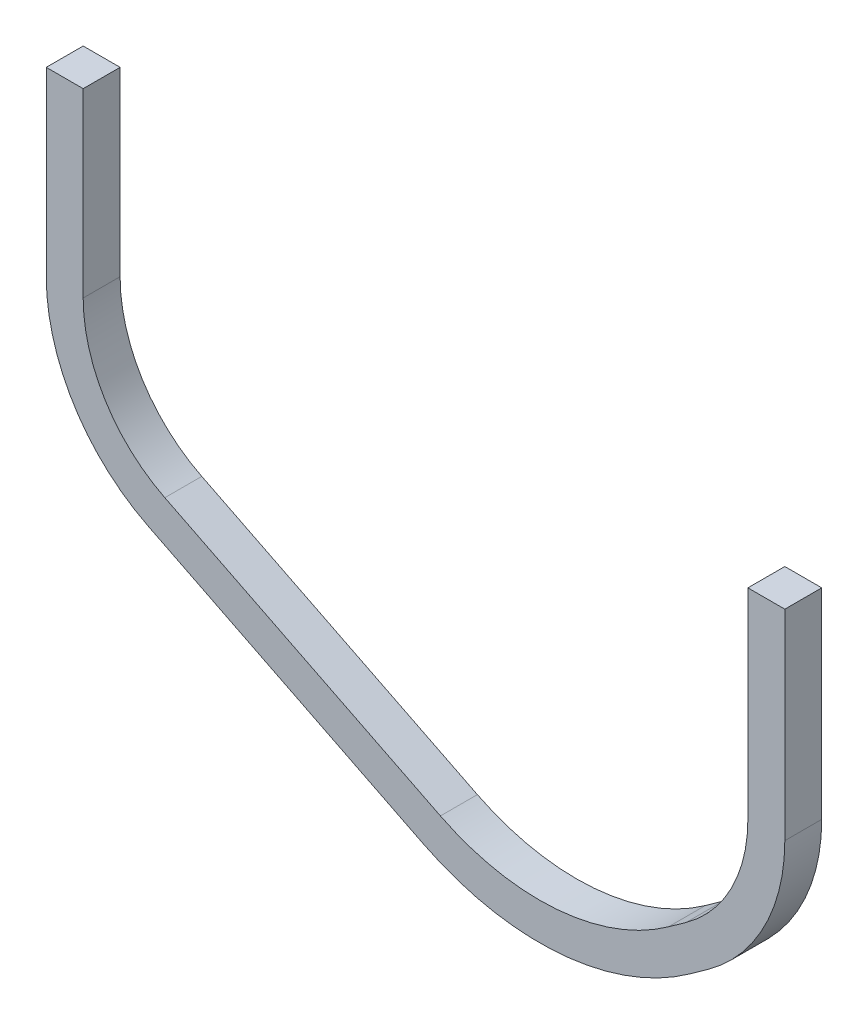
SolidWorks part; units mm, degrees
ref_plane "Plan de face" through (0, 0, 0) normal (0, 0, 1) x (1, 0, 0)
ref_plane "Plan de dessus" through (0, 0, 0) normal (0, 1, 0) x (1, 0, 0)
ref_plane "Plan de droite" through (0, 0, 0) normal (1, 0, 0) x (0, 0, -1)
sketch "Esquisse1" plane through (0, 0, 0) normal (0, 0, 1) x (1, 0, 0)
  line L0 (-10, 4) -> (-10, 0)
  line L1 (-10, 4) -> (-9.5, 4)
  line L2 (-9.8044, 0) -> (0.4118, 0) construction
  line L3 (-10, 0) -> (-3, -3.5)
  line L4 (-3, -3.5) -> (0, -1.3534)
  line L5 (0, -1.3534) -> (0, 2.6466)
  line L6 (-9.5, 4) -> (-9.5, 0.309)
  line L7 (-10, 0) -> (-1.7149, -4.1332) construction
  line L10 (-0.5, 2.6466) -> (0, 2.6466)
  line L11 (-9.5, 0.309) -> (-3.0459, -2.918)
  line L12 (-3.0459, -2.918) -> (-0.5, -1.0963)
  line L13 (-0.5, -1.0963) -> (-0.5, 2.6466)
  dimension "D1" = 4
  dimension "D2" = 10
  dimension "D3" = 1.3534
  dimension "D4" = 4
  dimension "D5" = 7
  dimension "D6" = 7
  dimension "D7" = 2.918
  dimension "D9" = 3.691
  dimension "D8" = 3.743
  dimension "D10" = 7.8262
  dimension "D11" = 6.4541
  dimension "D12" = 2.5459
  dimension "D13" = 0.5
  dimension "D14" = 0.5
extrude "Extrusion1" add sketch "Esquisse1" along normal mid plane 0.5
fillet "Congé1" radius 2 1 edges at (-9.5, 0.309, 0)
fillet "Congé2" radius 2.5 1 edges at (-10, 0, 0)
fillet "Congé3" radius 2.5 1 edges at (0, -1.3534, 0)
fillet "Congé4" radius 2 1 edges at (-0.5, -1.0963, 0)
fillet "Congé7" radius 3 1 edges at (-3.0459, -2.918, 0)
fillet "Congé8" radius 3.5 1 edges at (-3, -3.5, 0)
